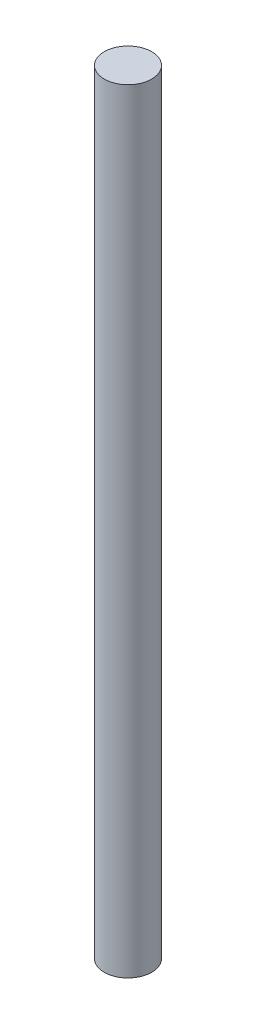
SolidWorks part; units mm, degrees
ref_plane "Front Plane" through (0, 0, 0) normal (0, 0, 1) x (1, 0, 0)
ref_plane "Top Plane" through (0, 0, 0) normal (0, 1, 0) x (1, 0, 0)
ref_plane "Right Plane" through (0, 0, 0) normal (1, 0, 0) x (0, 0, -1)
sketch "Sketch1" plane through (0, 0, 0) normal (0, 1, 0) x (1, 0, 0)
  circle A0 centre (0, 0) radius 3.175
  dimension "D1" = 6.35
extrude "Extrude1" add sketch "Sketch1" against normal blind 103.505
